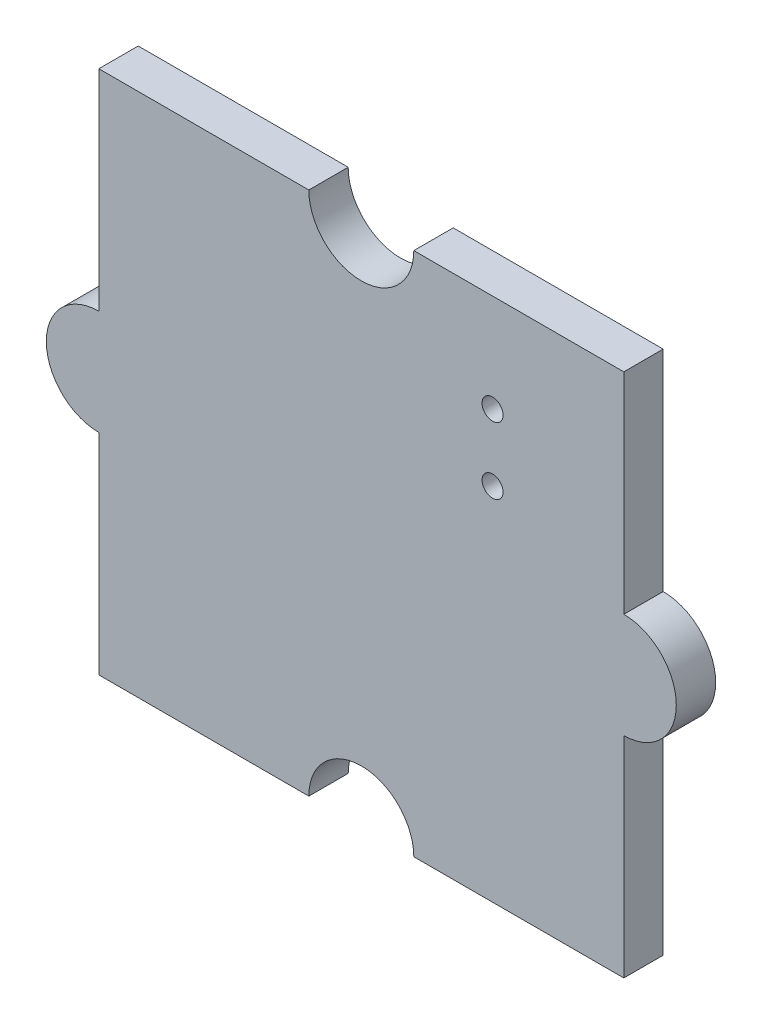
SolidWorks part; units mm, degrees
ref_plane "Plan de face" through (0, 0, 0) normal (0, 0, 1) x (1, 0, 0)
ref_plane "Plan de dessus" through (0, 0, 0) normal (0, 1, 0) x (1, 0, 0)
ref_plane "Plan de droite" through (0, 0, 0) normal (1, 0, 0) x (0, 0, -1)
sketch "Esquisse1" plane through (0, 0, 0) normal (0, 0, 1) x (1, 0, 0)
  line L0 (0, 12) -> (0, 20)
  line L1 (0, 0) -> (20, 0)
  line L2 (0, 0) -> (0, 8)
  line L3 (0, 20) -> (20, 20)
  line L4 (20, 0) -> (20, 8)
  line L5 (20, 12) -> (20, 20)
  arc A0 (0, 12) -> (0, 8) centre (0, 10) ccw
  arc A1 (20, 8) -> (20, 12) centre (20, 10) ccw
  dimension "D3" = 4
  dimension "D4" = 4
  dimension "D1" = 20
  dimension "D2" = 20
extrude "Boss.-Extru.1" add sketch "Esquisse1" along normal blind 1.5
sketch "Esquisse2" plane through (0, 0, 1.5) normal (0, 0, 1) x (1, 0, 0)
  line L0 (10, 15) -> (26.6969, 15) construction
  line L2 (20, 20) -> (0, 20) construction
  line L3 (20, 12) -> (20, 20) construction
  line L4 (0, 0) -> (20, 0) construction
  circle A0 centre (15, 13.73) radius 0.4
  circle A1 centre (15, 16.27) radius 0.4
  circle A2 centre (10, 20) radius 2
  circle A3 centre (10, 0) radius 2
  dimension "D1" = 1.27
  dimension "D4" = 4
  dimension "D5" = 4
  dimension "D2" = 5
  dimension "D3" = 5
extrude "Enlèv. mat.-Extru.1" cut sketch "Esquisse2" against normal blind 10
